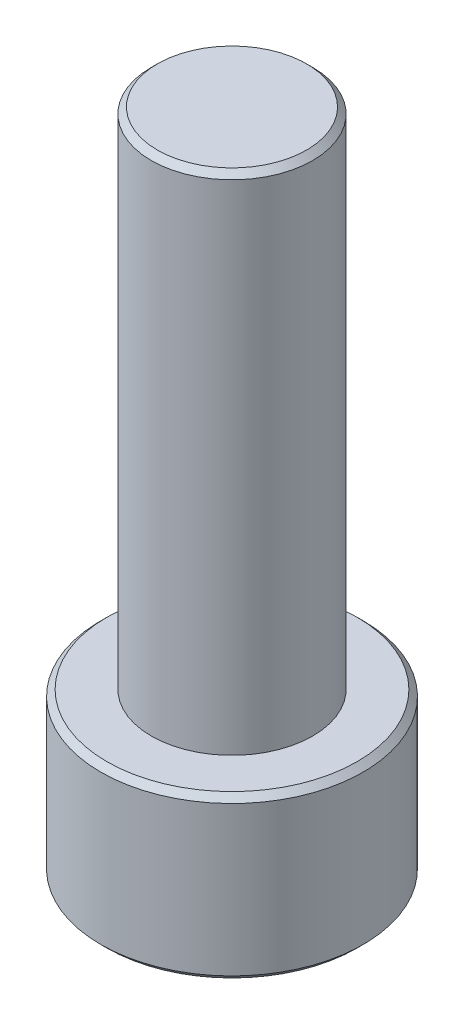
SolidWorks part; units mm, degrees
ref_plane "Front" through (0, 0, 0) normal (0, 0, 1) x (1, 0, 0)
ref_plane "Top" through (0, 0, 0) normal (0, 1, 0) x (1, 0, 0)
ref_plane "Right" through (0, 0, 0) normal (1, 0, 0) x (0, 0, -1)
sketch "Sketch1" plane through (0, 0, 0) normal (0, 1, 0) x (1, 0, 0)
  circle A0 centre (0, 0) radius 6.5
  dimension "D1" = 13
extrude "Boss-Extrude1" add sketch "Sketch1" along normal blind 8
sketch "Sketch2" plane through (0, 8, 0) normal (0, 1, 0) x (1, 0, 0)
  circle A0 centre (0, 0) radius 4
  dimension "D1" = 8
extrude "Boss-Extrude2" add sketch "Sketch2" along normal blind 25
chamfer "Chamfer1" distance 0.3 angle 45 2 edges at (0, 0, 6.5) (0, 8, 6.5)
chamfer "Chamfer2" distance 0.3 angle 45 1 edges at (0, 33, 4)
sketch "Sketch3" plane through (0, 0, 0) normal (0, -1, 0) x (1, 0, 0)
  line L1 (3.5218, 0) -> (1.7609, 3.05)
  line L2 (1.7609, 3.05) -> (-1.7609, 3.05)
  line L3 (-1.7609, 3.05) -> (-3.5218, 0)
  line L4 (-3.5218, 0) -> (-1.7609, -3.05)
  line L5 (-1.7609, -3.05) -> (1.7609, -3.05)
  line L6 (1.7609, -3.05) -> (3.5218, 0)
  circle A0 centre (0, 0) radius 3.05 construction
  dimension "D1" = 6.1
extrude "Cut-Extrude1" cut sketch "Sketch3" against normal blind 3
